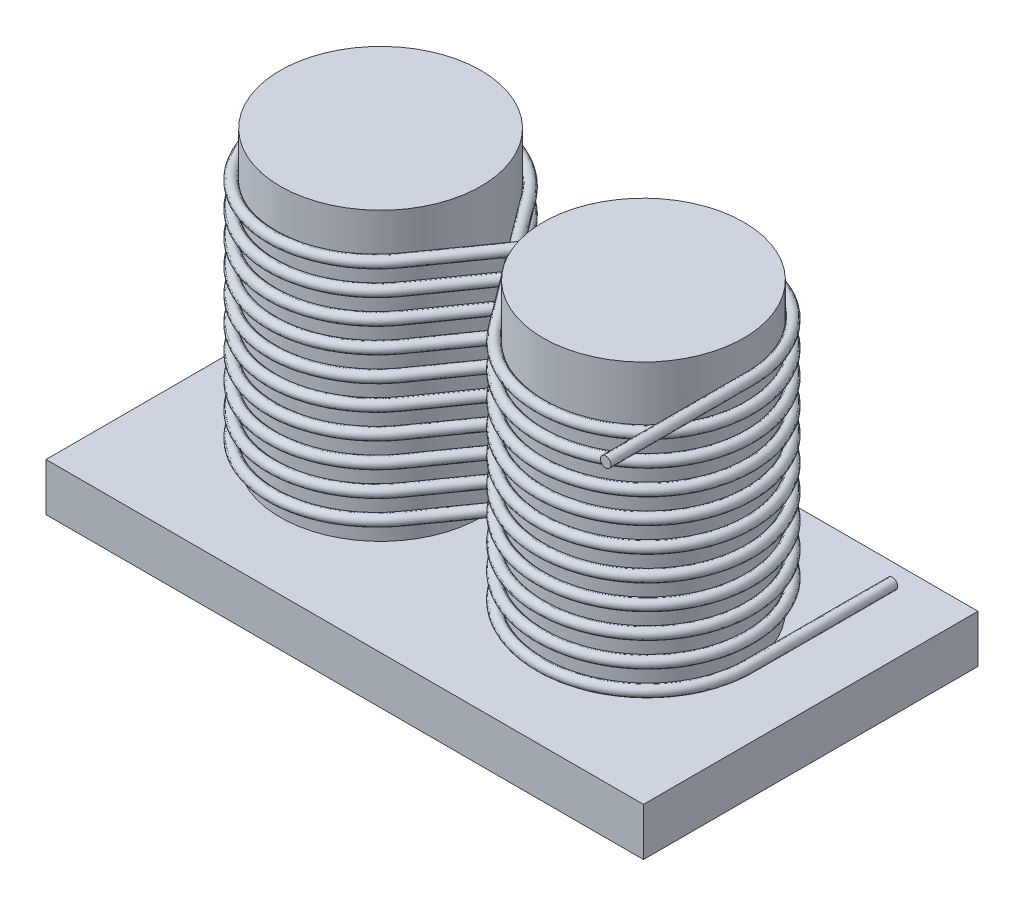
SolidWorks part; units mm, degrees
ref_plane "Ebene vorne" through (0, 0, 0) normal (0, 0, 1) x (1, 0, 0)
ref_plane "Ebene oben" through (0, 0, 0) normal (0, 1, 0) x (1, 0, 0)
ref_plane "Ebene rechts" through (0, 0, 0) normal (1, 0, 0) x (0, 0, -1)
sketch "Skizze9" plane through (0, 0, 0) normal (0, 1, 0) x (1, 0, 0)
  line L1 (-62.5, -35) -> (62.5, -35)
  line L2 (-62.5, -35) -> (-62.5, 35)
  line L3 (-62.5, 35) -> (62.5, 35)
  line L4 (62.5, -35) -> (62.5, 35)
  line L5 (-62.5, -35) -> (62.5, 35) construction
  line L6 (-62.5, 35) -> (62.5, -35) construction
  point P0 (0, 0)
  dimension "D1" = 70
  dimension "D2" = 125
extrude "Linear austragen3" add sketch "Skizze9" against normal blind 10
sketch "Skizze10" plane through (0, 0, 0) normal (0, 1, 0) x (1, 0, 0)
  circle A0 centre (27.5, 0) radius 21
  circle A1 centre (-27.5, 0) radius 21
  dimension "D1" = 42
  dimension "D2" = 42
  dimension "D3" = 27.5
  dimension "D4" = 27.5
extrude "Linear austragen4" add sketch "Skizze10" along normal blind 60
sketch "Skizze11" plane through (0, 0, 0) normal (0, 0, 1) x (1, 0, 0)
  line L0 (0, 0) -> (0, 14.7544)
  point P3 (0, 1.1)
  point P4 (0, 2.4)
  point P5 (0, 3.7)
  point P6 (0, 5)
  point P7 (0, 6.3)
  dimension "D1" = 1.1
  dimension "D2" = 1.3
  dimension "D3" = 2.6
  dimension "D4" = 1.3
  dimension "D5" = 2.6
ref_plane "Ebene5" through (0, 1.1, 0) normal (0, 1, 0) x (-1, 0, 0)
sketch3d "3D-Skizze13"
  line L3 (0, 2.4, 0) -> (9.7396, 2.1447, 13.1522)
  line L5 (-9.7396, 2.6553, -13.1522) -> (0, 2.4, 0)
  spline S2 degree 3 poles (49.6, 1.1, 0) (49.6, 1.1, 25.8036) (25.0959, 1.7422, 33.8889) (9.7396, 2.1447, 13.1522) knots 0 0 0 0 1 1 1 1 weights 1 0.542227 0.542227 1
  spline S6 degree 3 poles (-49.6, 3.7, 0) (-49.6, 3.7, -25.8036) (-25.0959, 3.0578, -33.8889) (-9.7396, 2.6553, -13.1522) knots 0.5 0.5 0.5 0.5 1 1 1 1 weights 1 0.542227 0.542227 1
sketch3d "3D-Skizze14"
  line L1 (0, 5, 0) -> (-9.7396, 4.7447, 13.1522)
  line L3 (9.7396, 5.2553, -13.1522) -> (0, 5, 0)
  spline S0 degree 3 poles (-49.6, 3.7, 0) (-49.6, 3.7, -25.8036) (-25.0959, 3.0578, -33.8889) (-9.7396, 2.6553, -13.1522) knots 0.5 0.5 0.5 0.5 1 1 1 1 weights 1 0.542227 0.542227 1 construction
  spline S1 degree 3 poles (-9.7396, 4.7447, 13.1522) (-25.0959, 4.3422, 33.8889) (-49.6, 3.7, 25.8036) (-49.6, 3.7, 0) knots 0 0 0 0 0.5 0.5 0.5 0.5 weights 1 0.542227 0.542227 1
  spline S3 degree 3 poles (9.7396, 5.2553, -13.1522) (25.0959, 5.6578, -33.8889) (49.6, 6.3, -25.8036) (49.6, 6.3, 0) knots 0 0 0 0 0.5 0.5 0.5 0.5 weights 1 0.542227 0.542227 1
curve "ZusammengKurve2"
sketch3d "3D-Skizze16"
  line L0 (-9.7396, 9.9447, 13.1522) -> (0, 10.2, 0) construction
  line L1 (0, 10.2, 0) -> (9.7396, 10.4553, -13.1522) construction
  line L2 (9.7396, 7.3447, 13.1522) -> (0, 7.6, 0) construction
  line L3 (0, 7.6, 0) -> (-9.7396, 7.8553, -13.1522) construction
  line L4 (0, 5, 0) -> (9.7396, 5.2553, -13.1522)
  line L5 (-9.7396, 4.7447, 13.1522) -> (0, 5, 0)
  line L6 (0, 2.4, 0) -> (-9.7396, 2.6553, -13.1522)
  line L7 (9.7396, 2.1447, 13.1522) -> (0, 2.4, 0)
  line L8 (0, 5, 0) -> (9.7396, 5.2553, -13.1522) construction
  line L9 (-9.7396, 4.7447, 13.1522) -> (0, 5, 0) construction
  line L10 (0, 2.4, 0) -> (-9.7396, 2.6553, -13.1522) construction
  line L11 (9.7396, 2.1447, 13.1522) -> (0, 2.4, 0) construction
  line L12 (-9.7396, 20.3447, 13.1522) -> (0, 20.6, 0) construction
  line L13 (-9.7396, 15.1447, 13.1522) -> (0, 15.4, 0) construction
  line L14 (0, 20.6, 0) -> (9.7396, 20.8553, -13.1522) construction
  line L15 (0, 12.8, 0) -> (-9.7396, 13.0553, -13.1522) construction
  line L16 (9.7396, 17.7447, 13.1522) -> (0, 18, 0) construction
  line L17 (0, 15.4, 0) -> (9.7396, 15.6553, -13.1522) construction
  line L18 (9.7396, 12.5447, 13.1522) -> (0, 12.8, 0) construction
  line L19 (0, 18, 0) -> (-9.7396, 18.2553, -13.1522) construction
  line L20 (0, 36.2, 0) -> (9.7396, 36.4553, -13.1522) construction
  line L21 (0, 31, 0) -> (9.7396, 31.2553, -13.1522) construction
  line L22 (-9.7396, 25.5447, 13.1522) -> (0, 25.8, 0) construction
  line L23 (0, 33.6, 0) -> (-9.7396, 33.8553, -13.1522) construction
  line L24 (-9.7396, 35.9447, 13.1522) -> (0, 36.2, 0) construction
  line L25 (-9.7396, 41.1447, 13.1522) -> (0, 41.4, 0) construction
  line L26 (9.7396, 28.1447, 13.1522) -> (0, 28.4, 0) construction
  line L27 (0, 23.2, 0) -> (-9.7396, 23.4553, -13.1522) construction
  line L28 (0, 41.4, 0) -> (9.7396, 41.6553, -13.1522) construction
  line L29 (9.7396, 38.5447, 13.1522) -> (0, 38.8, 0) construction
  line L30 (9.7396, 33.3447, 13.1522) -> (0, 33.6, 0) construction
  line L31 (0, 28.4, 0) -> (-9.7396, 28.6553, -13.1522) construction
  line L32 (9.7396, 22.9447, 13.1522) -> (0, 23.2, 0) construction
  line L33 (0, 38.8, 0) -> (-9.7396, 39.0553, -13.1522) construction
  line L34 (-9.7396, 30.7447, 13.1522) -> (0, 31, 0) construction
  line L35 (0, 25.8, 0) -> (9.7396, 26.0553, -13.1522) construction
  line L36 (-9.7396, 51.5447, 13.1522) -> (0, 51.8, 0) construction
  line L37 (9.7396, 43.7447, 13.1522) -> (0, 44, 0) construction
  line L38 (0, 46.6, 0) -> (9.7396, 46.8553, -13.1522) construction
  line L39 (0, 44, 0) -> (-9.7396, 44.2553, -13.1522) construction
  line L40 (-9.7396, 46.3447, 13.1522) -> (0, 46.6, 0) construction
  line L41 (9.7396, 48.9447, 13.1522) -> (0, 49.2, 0) construction
  line L42 (0, 49.2, 0) -> (-9.7396, 49.4553, -13.1522) construction
  line L43 (0, 51.8, 0) -> (9.7396, 52.0553, -13.1522) construction
  line L44 (49.6, 1.1, 0) -> (49.6, 1.1, -30) construction
  line L45 (49.6, 53.1, 0) -> (49.6, 53.1, 30) construction
  spline S0 degree 3 poles (9.7396, 10.4553, -13.1522) (25.0959, 10.8578, -33.8889) (49.6, 11.5, -25.8036) (49.6, 11.5, 0) knots 0 0 0 0 0.5 0.5 0.5 0.5 weights 1 0.542227 0.542227 1 construction
  spline S1 degree 3 poles (49.6, 6.3, 0) (49.6, 6.3, 25.8036) (25.0959, 6.9422, 33.8889) (9.7396, 7.3447, 13.1522) knots 0 0 0 0 1 1 1 1 weights 1 0.542227 0.542227 1 construction
  spline S2 degree 3 poles (-49.6, 8.9, 0) (-49.6, 8.9, 25.8036) (-25.0959, 9.5422, 33.8889) (-9.7396, 9.9447, 13.1522) knots 0 0 0 0 0.5 0.5 0.5 0.5 weights 1 0.542227 0.542227 1 construction
  spline S3 degree 3 poles (-9.7396, 7.8553, -13.1522) (-25.0959, 8.2578, -33.8889) (-49.6, 8.9, -25.8036) (-49.6, 8.9, 0) knots 0.5 0.5 0.5 0.5 1 1 1 1 weights 1 0.542227 0.542227 1 construction
  spline S4 degree 3 poles (9.7396, 5.2553, -13.1522) (25.0959, 5.6578, -33.8889) (49.6, 6.3, -25.8036) (49.6, 6.3, 0) knots 0 0 0 0 0.5 0.5 0.5 0.5 weights 1 0.542227 0.542227 1
  spline S5 degree 3 poles (-49.6, 3.7, 0) (-49.6, 3.7, 25.8036) (-25.0959, 4.3422, 33.8889) (-9.7396, 4.7447, 13.1522) knots 0 0 0 0 0.5 0.5 0.5 0.5 weights 1 0.542227 0.542227 1
  spline S6 degree 3 poles (-9.7396, 2.6553, -13.1522) (-25.0959, 3.0578, -33.8889) (-49.6, 3.7, -25.8036) (-49.6, 3.7, 0) knots 0.5 0.5 0.5 0.5 1 1 1 1 weights 1 0.542227 0.542227 1
  spline S7 degree 3 poles (49.6, 1.1, 0) (49.6, 1.1, 25.8036) (25.0959, 1.7422, 33.8889) (9.7396, 2.1447, 13.1522) knots 0 0 0 0 1 1 1 1 weights 1 0.542227 0.542227 1
  spline S8 degree 3 poles (9.7396, 5.2553, -13.1522) (25.0959, 5.6578, -33.8889) (49.6, 6.3, -25.8036) (49.6, 6.3, 0) knots 0 0 0 0 0.5 0.5 0.5 0.5 weights 1 0.542227 0.542227 1 construction
  spline S9 degree 3 poles (-49.6, 3.7, 0) (-49.6, 3.7, 25.8036) (-25.0959, 4.3422, 33.8889) (-9.7396, 4.7447, 13.1522) knots 0 0 0 0 0.5 0.5 0.5 0.5 weights 1 0.542227 0.542227 1 construction
  spline S10 degree 3 poles (-9.7396, 2.6553, -13.1522) (-25.0959, 3.0578, -33.8889) (-49.6, 3.7, -25.8036) (-49.6, 3.7, 0) knots 0.5 0.5 0.5 0.5 1 1 1 1 weights 1 0.542227 0.542227 1 construction
  spline S11 degree 3 poles (49.6, 1.1, 0) (49.6, 1.1, 25.8036) (25.0959, 1.7422, 33.8889) (9.7396, 2.1447, 13.1522) knots 0 0 0 0 1 1 1 1 weights 1 0.542227 0.542227 1 construction
  spline S12 degree 3 poles (-9.7396, 18.2553, -13.1522) (-25.0959, 18.6578, -33.8889) (-49.6, 19.3, -25.8036) (-49.6, 19.3, 0) knots 0.5 0.5 0.5 0.5 1 1 1 1 weights 1 0.542227 0.542227 1 construction
  spline S13 degree 3 poles (9.7396, 15.6553, -13.1522) (25.0959, 16.0578, -33.8889) (49.6, 16.7, -25.8036) (49.6, 16.7, 0) knots 0 0 0 0 0.5 0.5 0.5 0.5 weights 1 0.542227 0.542227 1 construction
  spline S14 degree 3 poles (-49.6, 19.3, 0) (-49.6, 19.3, 25.8036) (-25.0959, 19.9422, 33.8889) (-9.7396, 20.3447, 13.1522) knots 0 0 0 0 0.5 0.5 0.5 0.5 weights 1 0.542227 0.542227 1 construction
  spline S15 degree 3 poles (-49.6, 14.1, 0) (-49.6, 14.1, 25.8036) (-25.0959, 14.7422, 33.8889) (-9.7396, 15.1447, 13.1522) knots 0 0 0 0 0.5 0.5 0.5 0.5 weights 1 0.542227 0.542227 1 construction
  spline S16 degree 3 poles (49.6, 16.7, 0) (49.6, 16.7, 25.8036) (25.0959, 17.3422, 33.8889) (9.7396, 17.7447, 13.1522) knots 0 0 0 0 1 1 1 1 weights 1 0.542227 0.542227 1 construction
  spline S17 degree 3 poles (49.6, 11.5, 0) (49.6, 11.5, 25.8036) (25.0959, 12.1422, 33.8889) (9.7396, 12.5447, 13.1522) knots 0 0 0 0 1 1 1 1 weights 1 0.542227 0.542227 1 construction
  spline S18 degree 3 poles (-9.7396, 13.0553, -13.1522) (-25.0959, 13.4578, -33.8889) (-49.6, 14.1, -25.8036) (-49.6, 14.1, 0) knots 0.5 0.5 0.5 0.5 1 1 1 1 weights 1 0.542227 0.542227 1 construction
  spline S19 degree 3 poles (9.7396, 20.8553, -13.1522) (25.0959, 21.2578, -33.8889) (49.6, 21.9, -25.8036) (49.6, 21.9, 0) knots 0 0 0 0 0.5 0.5 0.5 0.5 weights 1 0.542227 0.542227 1 construction
  spline S20 degree 3 poles (-9.7396, 28.6553, -13.1522) (-25.0959, 29.0578, -33.8889) (-49.6, 29.7, -25.8036) (-49.6, 29.7, 0) knots 0.5 0.5 0.5 0.5 1 1 1 1 weights 1 0.542227 0.542227 1 construction
  spline S21 degree 3 poles (-49.6, 24.5, 0) (-49.6, 24.5, 25.8036) (-25.0959, 25.1422, 33.8889) (-9.7396, 25.5447, 13.1522) knots 0 0 0 0 0.5 0.5 0.5 0.5 weights 1 0.542227 0.542227 1 construction
  spline S22 degree 3 poles (49.6, 21.9, 0) (49.6, 21.9, 25.8036) (25.0959, 22.5422, 33.8889) (9.7396, 22.9447, 13.1522) knots 0 0 0 0 1 1 1 1 weights 1 0.542227 0.542227 1 construction
  spline S23 degree 3 poles (-49.6, 29.7, 0) (-49.6, 29.7, 25.8036) (-25.0959, 30.3422, 33.8889) (-9.7396, 30.7447, 13.1522) knots 0 0 0 0 0.5 0.5 0.5 0.5 weights 1 0.542227 0.542227 1 construction
  spline S24 degree 3 poles (49.6, 37.5, 0) (49.6, 37.5, 25.8036) (25.0959, 38.1422, 33.8889) (9.7396, 38.5447, 13.1522) knots 0 0 0 0 1 1 1 1 weights 1 0.542227 0.542227 1 construction
  spline S25 degree 3 poles (-9.7396, 23.4553, -13.1522) (-25.0959, 23.8578, -33.8889) (-49.6, 24.5, -25.8036) (-49.6, 24.5, 0) knots 0.5 0.5 0.5 0.5 1 1 1 1 weights 1 0.542227 0.542227 1 construction
  spline S26 degree 3 poles (49.6, 32.3, 0) (49.6, 32.3, 25.8036) (25.0959, 32.9422, 33.8889) (9.7396, 33.3447, 13.1522) knots 0 0 0 0 1 1 1 1 weights 1 0.542227 0.542227 1 construction
  spline S27 degree 3 poles (49.6, 27.1, 0) (49.6, 27.1, 25.8036) (25.0959, 27.7422, 33.8889) (9.7396, 28.1447, 13.1522) knots 0 0 0 0 1 1 1 1 weights 1 0.542227 0.542227 1 construction
  spline S28 degree 3 poles (-9.7396, 33.8553, -13.1522) (-25.0959, 34.2578, -33.8889) (-49.6, 34.9, -25.8036) (-49.6, 34.9, 0) knots 0.5 0.5 0.5 0.5 1 1 1 1 weights 1 0.542227 0.542227 1 construction
  spline S29 degree 3 poles (9.7396, 31.2553, -13.1522) (25.0959, 31.6578, -33.8889) (49.6, 32.3, -25.8036) (49.6, 32.3, 0) knots 0 0 0 0 0.5 0.5 0.5 0.5 weights 1 0.542227 0.542227 1 construction
  spline S30 degree 3 poles (-49.6, 40.1, 0) (-49.6, 40.1, 25.8036) (-25.0959, 40.7422, 33.8889) (-9.7396, 41.1447, 13.1522) knots 0 0 0 0 0.5 0.5 0.5 0.5 weights 1 0.542227 0.542227 1 construction
  spline S31 degree 3 poles (9.7396, 26.0553, -13.1522) (25.0959, 26.4578, -33.8889) (49.6, 27.1, -25.8036) (49.6, 27.1, 0) knots 0 0 0 0 0.5 0.5 0.5 0.5 weights 1 0.542227 0.542227 1 construction
  spline S32 degree 3 poles (9.7396, 36.4553, -13.1522) (25.0959, 36.8578, -33.8889) (49.6, 37.5, -25.8036) (49.6, 37.5, 0) knots 0 0 0 0 0.5 0.5 0.5 0.5 weights 1 0.542227 0.542227 1 construction
  spline S33 degree 3 poles (-49.6, 34.9, 0) (-49.6, 34.9, 25.8036) (-25.0959, 35.5422, 33.8889) (-9.7396, 35.9447, 13.1522) knots 0 0 0 0 0.5 0.5 0.5 0.5 weights 1 0.542227 0.542227 1 construction
  spline S34 degree 3 poles (9.7396, 41.6553, -13.1522) (25.0959, 42.0578, -33.8889) (49.6, 42.7, -25.8036) (49.6, 42.7, 0) knots 0 0 0 0 0.5 0.5 0.5 0.5 weights 1 0.542227 0.542227 1 construction
  spline S35 degree 3 poles (-9.7396, 39.0553, -13.1522) (-25.0959, 39.4578, -33.8889) (-49.6, 40.1, -25.8036) (-49.6, 40.1, 0) knots 0.5 0.5 0.5 0.5 1 1 1 1 weights 1 0.542227 0.542227 1 construction
  spline S36 degree 3 poles (-49.6, 45.3, 0) (-49.6, 45.3, 25.8036) (-25.0959, 45.9422, 33.8889) (-9.7396, 46.3447, 13.1522) knots 0 0 0 0 0.5 0.5 0.5 0.5 weights 1 0.542227 0.542227 1 construction
  spline S37 degree 3 poles (9.7396, 52.0553, -13.1522) (25.0959, 52.4578, -33.8889) (49.6, 53.1, -25.8036) (49.6, 53.1, 0) knots 0 0 0 0 0.5 0.5 0.5 0.5 weights 1 0.542227 0.542227 1 construction
  spline S38 degree 3 poles (-9.7396, 49.4553, -13.1522) (-25.0959, 49.8578, -33.8889) (-49.6, 50.5, -25.8036) (-49.6, 50.5, 0) knots 0.5 0.5 0.5 0.5 1 1 1 1 weights 1 0.542227 0.542227 1 construction
  spline S39 degree 3 poles (49.6, 47.9, 0) (49.6, 47.9, 25.8036) (25.0959, 48.5422, 33.8889) (9.7396, 48.9447, 13.1522) knots 0 0 0 0 1 1 1 1 weights 1 0.542227 0.542227 1 construction
  spline S40 degree 3 poles (9.7396, 46.8553, -13.1522) (25.0959, 47.2578, -33.8889) (49.6, 47.9, -25.8036) (49.6, 47.9, 0) knots 0 0 0 0 0.5 0.5 0.5 0.5 weights 1 0.542227 0.542227 1 construction
  spline S41 degree 3 poles (-49.6, 50.5, 0) (-49.6, 50.5, 25.8036) (-25.0959, 51.1422, 33.8889) (-9.7396, 51.5447, 13.1522) knots 0 0 0 0 0.5 0.5 0.5 0.5 weights 1 0.542227 0.542227 1 construction
  spline S42 degree 3 poles (49.6, 42.7, 0) (49.6, 42.7, 25.8036) (25.0959, 43.3422, 33.8889) (9.7396, 43.7447, 13.1522) knots 0 0 0 0 1 1 1 1 weights 1 0.542227 0.542227 1 construction
  spline S43 degree 3 poles (-9.7396, 44.2553, -13.1522) (-25.0959, 44.6578, -33.8889) (-49.6, 45.3, -25.8036) (-49.6, 45.3, 0) knots 0.5 0.5 0.5 0.5 1 1 1 1 weights 1 0.542227 0.542227 1 construction
  spline S44 degree 3 number of poles 962 (49.6, 53.1, 30) -> (49.6, 1.1, -30)
  dimension "D2" = 30
  dimension "D1" = 0
ref_plane "Ebene11" through (49.6, 1.1, -30) normal (0, 0, -1) x (-1, 0, 0)
sketch "Skizze15" plane through (49.6, 1.1, -30) normal (0, 0, -1) x (-1, 0, 0)
  circle A0 centre (0, 0) radius 1.1
  dimension "D1" = 2.2
sweep "Austragung5" add profiles "Skizze15" path "3D-Skizze16"
equation "\"Zylinder_Durchmesser\"= 42"
equation "\"Zylinder_Abstand\"= 13"
equation "\"POF_Durchmesser\"= 2.2"
equation "\"POF_Abstand\"= 3"
equation "\"D1@Skizze9\" = \"Zylinder_Durchmesser\"+28"
equation "\"D2@Skizze9\" = 2*\"Zylinder_Durchmesser\"+\"Zylinder_Abstand\"+28"
equation "\"D1@Skizze10\" = \"Zylinder_Durchmesser\""
equation "\"D2@Skizze10\" = \"Zylinder_Durchmesser\""
equation "\"D3@Skizze10\" = (\"Zylinder_Durchmesser\" + \"Zylinder_Abstand\")/2"
equation "\"D4@Skizze10\" = (\"Zylinder_Durchmesser\" + \"Zylinder_Abstand\")/2"
equation "\"D1@Skizze11\" = \"POF_Durchmesser\"/2"
equation "\"D3@Skizze11\" =  (\"POF_Durchmesser\"+\"POF_Abstand\")/2"
equation "\"D2@Skizze11\" = \"D3@Skizze11\"/2"
equation "\"D5@Skizze11\" = \"D3@Skizze11\""
equation "\"D4@Skizze11\" = \"D3@Skizze11\"/2"
equation "\"D1@Skizze15\" = \"POF_Durchmesser\""
